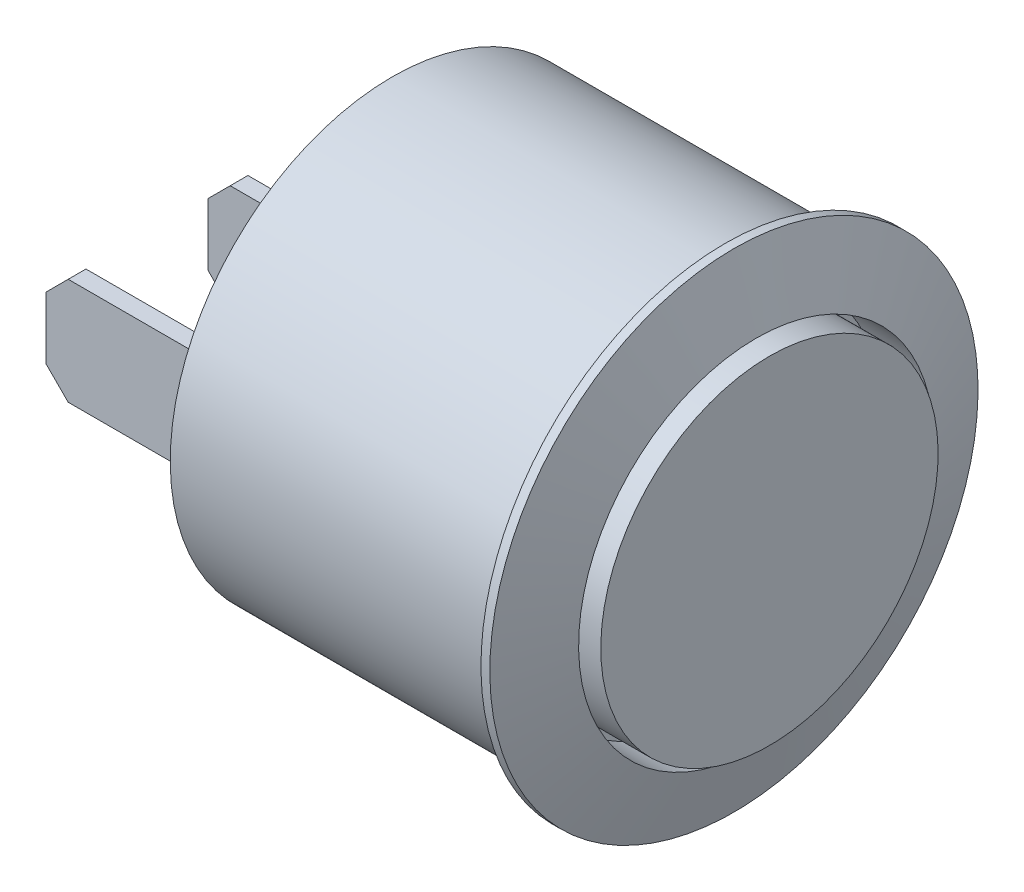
SolidWorks part; units mm, degrees
ref_plane "Plan de face" through (0, 0, 0) normal (0, 0, 1) x (1, 0, 0)
ref_plane "Plan de dessus" through (0, 0, 0) normal (0, 1, 0) x (1, 0, 0)
ref_plane "Plan de droite" through (0, 0, 0) normal (1, 0, 0) x (0, 0, -1)
sketch "Esquisse1" plane through (0, 0, 0) normal (0, 0, 1) x (1, 0, 0)
  line L0 (-33.2098, 0) -> (-33.2098, 10)
  line L1 (-33.2098, 10) -> (-18.2098, 10)
  line L2 (-18.2098, 10) -> (-18.2098, 11)
  line L3 (-18.2098, 11) -> (-17.8098, 11)
  line L4 (-17.8098, 11) -> (-16.8098, 8)
  line L5 (-16.8098, 8) -> (-19.2098, 8)
  line L6 (-19.2098, 8) -> (-19.2098, 0)
  line L7 (-19.2098, 0) -> (-33.2098, 0)
  dimension "D1" = 10
  dimension "D2" = 15
  dimension "D3" = 11
  dimension "D4" = 0.4
  dimension "D5" = 8
  dimension "D6" = 16.4
revolve "Révolution1" add sketch "Esquisse1" angle 360 about L7
sketch "Esquisse2" plane through (-19.2098, 0, 0) normal (1, 0, 0) x (0, 0, -1)
  circle A0 centre (0, 0) radius 7.6
extrude "Boss.-Extru.1" add sketch "Esquisse2" along normal blind 3
sketch "Esquisse3" plane through (-33.2098, 0, 0) normal (-1, 0, 0) x (0, 0, 1)
  line L0 (-0.1, 2.4) -> (-0.1, 3.457) construction
  line L1 (-0.5, 2.4) -> (0.3, 2.4)
  line L2 (-0.5, 2.4) -> (-0.5, -2.4)
  line L3 (-0.5, -2.4) -> (0.3, -2.4)
  line L4 (0.3, 2.4) -> (0.3, -2.4)
  line L5 (6.8, 2.4) -> (7.6, 2.4)
  line L6 (6.8, 2.4) -> (6.8, -2.4)
  line L7 (6.8, -2.4) -> (7.6, -2.4)
  line L8 (7.6, 2.4) -> (7.6, -2.4)
  line L9 (-7.8, 2.4) -> (-7.8, -2.4)
  line L10 (-7, -2.4) -> (-7.8, -2.4)
  line L11 (-7, 2.4) -> (-7, -2.4)
  line L12 (-7, 2.4) -> (-7.8, 2.4)
  dimension "D1" = 0.8
  dimension "D2" = 0.5
  dimension "D3" = 2.4
  dimension "D4" = 2.4
  dimension "D5" = 0
  dimension "D6" = 0
  dimension "D7" = 0.8
  dimension "D8" = 6.5
extrude "Boss.-Extru.2" add sketch "Esquisse3" along normal blind 8
chamfer "Chanfrein1" distance 1 angle 45 6 edges at (-41.2098, -2.4, 7.2) (-41.2098, 2.4, 7.2) (-41.2098, 2.4, -0.1) (-41.2098, -2.4, -0.1) (-41.2098, -2.4, -7.4) (-41.2098, 2.4, -7.4)
